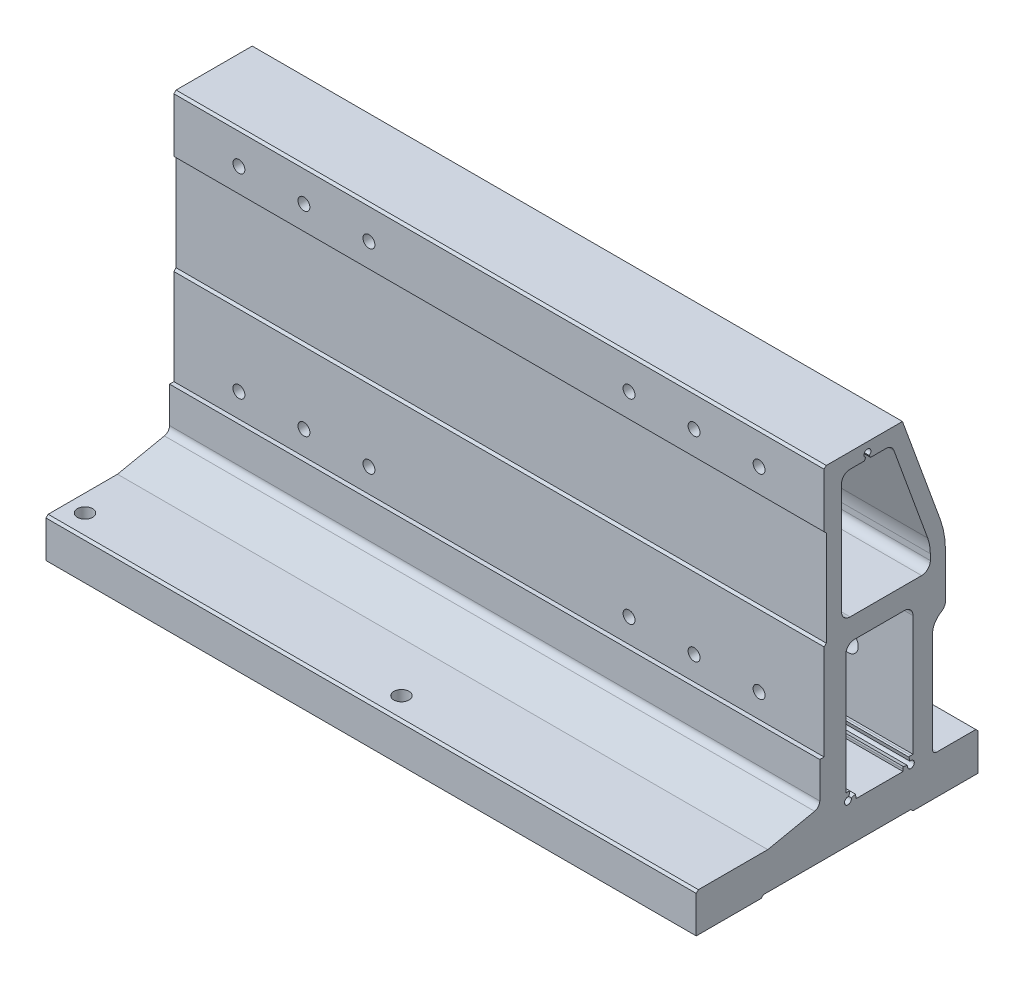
SolidWorks part; units mm, degrees
ref_plane "정면" through (0, 0, 0) normal (0, 0, 1) x (1, 0, 0)
ref_plane "윗면" through (0, 0, 0) normal (0, 1, 0) x (1, 0, 0)
ref_plane "우측면" through (0, 0, 0) normal (1, 0, 0) x (0, 0, -1)
sketch "스케치1" plane through (0, 0, 0) normal (1, 0, 0) x (0, 0, -1)
  line L0 (65, 16) -> (64, 17)
  line L1 (64, 17) -> (46, 17)
  line L2 (44, 19) -> (44, 65)
  line L3 (50, 75.3923) -> (50, 95.442)
  line L4 (47.5845, 109.1317) -> (30.149, 157)
  line L5 (30.149, 157) -> (-5, 157)
  line L6 (-5, 157) -> (-6, 156)
  line L7 (-6, 156) -> (-6, 131)
  line L8 (-6, 131) -> (-5, 130)
  line L9 (-5, 130) -> (-5, 86)
  line L10 (-5, 86) -> (-6, 85)
  line L11 (-6, 85) -> (-6, 40.9998)
  line L12 (-6, 40.9998) -> (-8, 40.9998)
  line L13 (-8, 40.9998) -> (-8, 24.4394)
  line L14 (-10.3881, 21.5025) -> (-32, 17)
  line L15 (-32, 17) -> (-64, 17)
  line L16 (-64, 17) -> (-65, 16)
  line L17 (-65, 16) -> (-65, -1)
  line L18 (-65, -1) -> (-35, -1)
  line L19 (-35, -1) -> (-34, 0)
  line L20 (-34, 0) -> (34, 0)
  line L21 (34, 0) -> (35, -1)
  line L22 (35, -1) -> (65, -1)
  line L23 (65, -1) -> (65, 16)
  line L24 (2, 146) -> (2, 95)
  line L25 (6, 91) -> (39, 91)
  line L26 (43, 95) -> (43, 97.7359)
  line L27 (41.7922, 104.5807) -> (26.2071, 147.369)
  line L28 (22.4487, 150) -> (15.4434, 150)
  line L29 (15.4434, 150) -> (14.8, 151.1144)
  line L30 (13.2, 151.1144) -> (12.5566, 150)
  line L31 (12.5566, 150) -> (6, 150)
  line L32 (4, 21.6) -> (4, 77)
  line L33 (8, 81) -> (31, 81)
  line L34 (35, 77) -> (35, 21.6)
  line L35 (35, 21.6) -> (34, 21.6)
  line L36 (33.0683, 21.4773) -> (33.5859, 19.5455)
  line L37 (32.4545, 18.4141) -> (30.5227, 18.9317)
  line L38 (30.4, 18) -> (30.4, 17)
  line L39 (30.4, 17) -> (8.6, 17)
  line L40 (8.6, 17) -> (8.6, 18)
  line L41 (8.4773, 18.9317) -> (6.5455, 18.4141)
  line L42 (5.4141, 19.5455) -> (5.9317, 21.4773)
  line L43 (5, 21.6) -> (4, 21.6)
  arc A0 (44, 19) -> (46, 17) centre (46, 19) ccw
  arc A1 (48, 71.9282) -> (44, 65) centre (52, 65) ccw
  arc A2 (48, 71.9282) -> (50, 75.3923) centre (46, 75.3923) ccw
  arc A3 (50, 95.442) -> (47.5845, 109.1317) centre (10, 95.442) ccw
  arc A4 (-10.3881, 21.5025) -> (-8, 24.4394) centre (-11, 24.4394) ccw
  arc A5 (6, 150) -> (2, 146) centre (6, 146) ccw
  arc A6 (2, 95) -> (6, 91) centre (6, 95) ccw
  arc A7 (39, 91) -> (43, 95) centre (39, 95) ccw
  arc A8 (43, 97.7359) -> (41.7922, 104.5807) centre (23, 97.7359) ccw
  arc A9 (26.2071, 147.369) -> (22.4487, 150) centre (22.4487, 146) ccw
  arc A10 (14.8, 151.1144) -> (13.2, 151.1144) centre (14, 152.5) ccw
  arc A11 (8, 81) -> (4, 77) centre (8, 77) ccw
  arc A12 (35, 77) -> (31, 81) centre (31, 77) ccw
  arc A13 (34, 21.6) -> (33.0683, 21.4773) centre (34, 18) ccw
  arc A14 (32.4545, 18.4141) -> (33.5859, 19.5455) centre (34, 18) ccw
  arc A15 (30.5227, 18.9317) -> (30.4, 18) centre (34, 18) ccw
  arc A16 (8.6, 18) -> (8.4773, 18.9317) centre (5, 18) ccw
  arc A17 (5.4141, 19.5455) -> (6.5455, 18.4141) centre (5, 18) ccw
  arc A18 (5.9317, 21.4773) -> (5, 21.6) centre (5, 18) ccw
extrude "보스-돌출1" add sketch "스케치1" along normal mid plane 300
hole_wizard "M5 소켓 머리 캡 나사용 카운터보어1" positions "스케치2" profile "스케치3" counterbore size "M5" standard "KS"
sketch "스케치2" plane through (0, 0, -50) normal (0, 0, -1) x (-1, 0, 0)
  line L0 (-150, 109.1317) -> (-150, 157) construction
  line L1 (-150, -1) -> (150, -1) construction
  point P0 (-120, 142)
  point P2 (-90, 142)
  point P4 (-60, 142)
  point P7 (-120, 52)
  point P9 (-90, 52)
  point P11 (-60, 52)
  dimension "D1" = 30
  dimension "D2" = 30
  dimension "D3" = 30
  dimension "D4" = 90
  dimension "D5" = 53
sketch "스케치3" plane through (120, 142, -50) normal (1, 0, 0) x (0, 1, 0)
  line L0 (0, 0) -> (0, 115)
  line L1 (0, 115) -> (2.75, 115)
  line L3 (2.75, 115) -> (2.75, 49)
  line L4 (2.75, 49) -> (4.75, 49)
  line L5 (4.75, 49) -> (4.75, 0)
  line L7 (4.75, 0) -> (0, 0)
  line L11 (0, -6.35) -> (0, 107.95) construction
  dimension "관통 구멍 지름" = 5.5
  dimension "관통 구멍 깊이" = 115
  dimension "카운터보어 지름" = 9.5
  dimension "카운터보어 깊이" = 49
pattern_linear "선형 패턴1" count 2 spacing 180 along (-1, 0, 0) of "M5 소켓 머리 캡 나사용 카운터보어1"
hole_wizard "M5 나사 구멍1" positions "스케치4" profile "스케치5" tap size "M5" standard "ISO"
sketch "스케치4" plane through (-150, 0, 0) normal (-1, 0, 0) x (0, 0, 1)
  line L0 (-65, -1) -> (-65, 16) construction
  line L1 (-35, -1) -> (-65, -1) construction
  point P0 (-45, 8)
  point P2 (-9, 8)
  dimension "D1" = 36
  dimension "D2" = 20
  dimension "D3" = 9
sketch "스케치5" plane through (-150, 8, -45) normal (0, 1, 0) x (0, 0, 1)
  line L0 (0, 0) -> (0, 13.2618)
  line L1 (0, 13.2618) -> (2.1, 12)
  line L2 (2.1, 12) -> (2.1, 0.425)
  line L3 (2.1, 0.425) -> (2.525, 0)
  line L5 (2.525, 0) -> (0, 0)
  line L6 (-2.1, 0.425) -> (-2.525, 0) construction
  line L10 (0, 13.2618) -> (-2.1, 12) construction
  line L11 (0, -6.35) -> (0, 107.95) construction
  dimension "탭 드릴 지름" = 4.2
  dimension "탭 드릴 깊이" = 12
  dimension "표면 카운터싱크 지름" = 5.05
  dimension "표면 카운터싱크 각도" = 90
  dimension "드릴 각도" = 118
hole_wizard "Ø5.0mm 맞춤핀 구멍1" positions "스케치6" profile "스케치7" hole size "Ø5.0" standard "ISO"
sketch "스케치6" plane through (0, 0, 0) normal (0, -1, 0) x (-1, 0, 0)
  line L0 (0, 0) -> (162.3174, 0) construction
  line L1 (150, -34) -> (150, 34) construction
  point P5 (142, 0)
  point P7 (-4, 0)
  dimension "D1" = 146
  dimension "D2" = 8
sketch "스케치7" plane through (4, 0, 0) normal (1, 0, 0) x (0, 0, -1)
  line L0 (0, 0) -> (0, 11.5022)
  line L1 (0, 11.5022) -> (2.5, 10)
  line L2 (2.5, 10) -> (2.5, 0)
  line L5 (2.5, 0) -> (0, 0)
  line L10 (0, 11.5022) -> (-2.5, 10) construction
  line L11 (0, -6.35) -> (0, 107.95) construction
  dimension "구멍 지름" = 5
  dimension "구멍 깊이" = 10
  dimension "드릴 각도" = 118
hole_wizard "Ø7.0 (7) 지름 구멍1" positions "스케치8" profile "스케치9" hole size "Ø7.0" standard "ISO"
sketch "스케치8" plane through (0, -1, 0) normal (0, -1, 0) x (-1, 0, 0)
  line L0 (-150, 65) -> (150, 65) construction
  line L1 (150, -65) -> (150, -35) construction
  point P0 (142, -55)
  point P2 (-4, -55)
  point P4 (142, 55)
  point P6 (-4, 55)
  dimension "D1" = 10
  dimension "D2" = 110
  dimension "D3" = 8
  dimension "D4" = 146
sketch "스케치9" plane through (-142, -1, 55) normal (1, 0, 0) x (0, 0, -1)
  line L0 (0, 0) -> (0, 158)
  line L1 (0, 158) -> (3.5, 158)
  line L2 (3.5, 158) -> (3.5, 0)
  line L5 (3.5, 0) -> (0, 0)
  line L11 (0, -6.35) -> (0, 107.95) construction
  dimension "관통 구멍 지름" = 7
  dimension "관통 구멍 깊이" = 158
